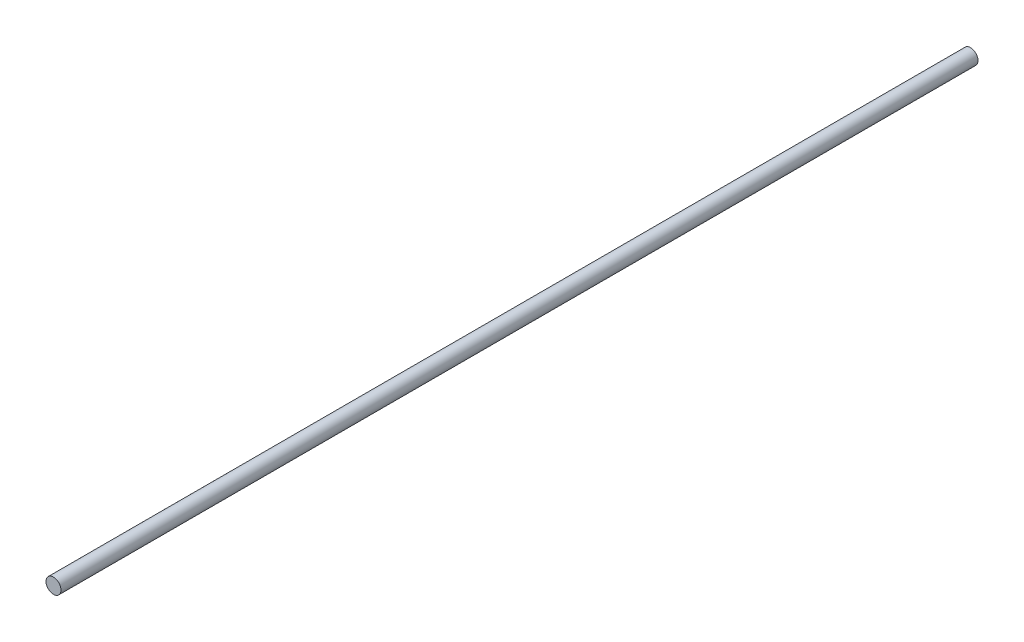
SolidWorks part; units mm, degrees
ref_plane "Face" through (0, 0, 0) normal (0, 0, 1) x (1, 0, 0)
ref_plane "Dessus" through (0, 0, 0) normal (0, 1, 0) x (1, 0, 0)
ref_plane "Droite" through (0, 0, 0) normal (1, 0, 0) x (0, 0, -1)
sketch "Esquisse1" plane through (0, 0, 0) normal (0, 0, 1) x (1, 0, 0)
  circle A0 centre (0, 0) radius 2
  dimension "D1" = 4
extrude "Base-Extrusion" add sketch "Esquisse1" along normal mid plane 245
